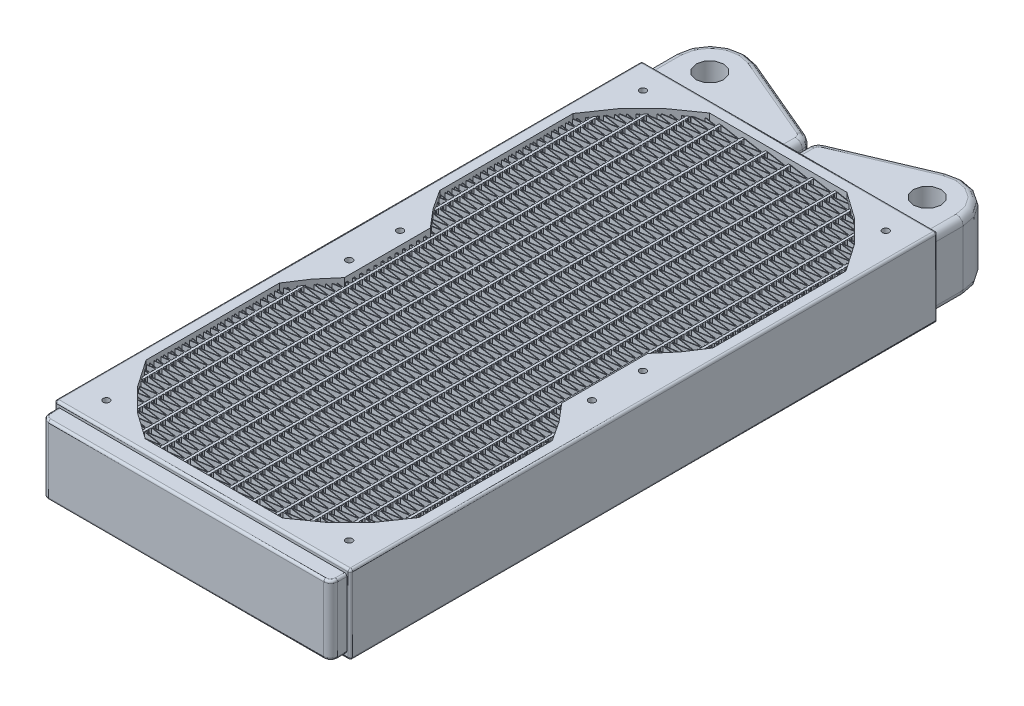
SolidWorks part; units mm, degrees
ref_plane "Front" through (0, 0, 0) normal (0, 0, 1) x (1, 0, 0)
ref_plane "Top" through (0, 0, 0) normal (0, 1, 0) x (1, 0, 0)
ref_plane "Right" through (0, 0, 0) normal (1, 0, 0) x (0, 0, -1)
sketch "Sketch1" plane through (0, 0, 0) normal (0, 1, 0) x (1, 0, 0)
  line L0 (-64, 7) -> (64, 7)
  line L1 (-64, 289) -> (64, 289) construction
  line L2 (-64, 289) -> (-64, 0) construction
  line L3 (-64, 0) -> (64, 0) construction
  line L4 (64, 289) -> (64, 0) construction
  line L5 (64, 7) -> (64, 261)
  line L6 (64, 261) -> (-64, 261)
  line L7 (-64, 261) -> (-64, 7)
  line L8 (0, -618) -> (0, 49382) construction
  line L9 (29.6957, 256) -> (-29.6957, 256)
  line L10 (-59, 226.3259) -> (-59, 168.6741)
  line L11 (-52.5, 145) -> (52.5, 250) construction
  line L12 (-52.5, 250) -> (52.5, 145) construction
  line L13 (-47, 152.5955) -> (-47, 115.4045)
  line L14 (59, 226.3259) -> (59, 168.6741)
  line L15 (47, 152.5955) -> (47, 115.4045)
  line L16 (-47, 134) -> (47, 134) construction
  line L17 (-52.5, 123) -> (52.5, 18) construction
  line L18 (-52.5, 18) -> (52.5, 123) construction
  line L20 (59, 99.3259) -> (59, 41.6741)
  line L21 (-59, 99.3259) -> (-59, 41.6741)
  line L27 (29.6957, 12) -> (-29.6957, 12)
  arc A0 (-29.6957, 256) -> (-59, 226.3259) centre (10.6066, 186.8934) ccw
  arc A1 (-59, 168.6741) -> (-47, 152.5955) centre (10.6066, 208.1066) ccw
  circle A2 centre (0, 197.5) radius 60 construction
  arc A3 (29.6957, 256) -> (59, 226.3259) centre (-10.6066, 186.8934) cw
  arc A4 (59, 168.6741) -> (47, 152.5955) centre (-10.6066, 208.1066) cw
  arc A5 (-59, 99.3259) -> (-47, 115.4045) centre (10.6066, 59.8934) cw
  arc A6 (59, 99.3259) -> (47, 115.4045) centre (-10.6066, 59.8934) ccw
  circle A7 centre (0, 70.5) radius 60 construction
  arc A14 (29.6957, 12) -> (59, 41.6741) centre (-10.6066, 81.1066) ccw
  arc A15 (-29.6957, 12) -> (-59, 41.6741) centre (10.6066, 81.1066) cw
  point P12 (0, 261)
  point P19 (-52.5, 250)
  point P20 (-52.5, 145)
  point P21 (52.5, 145)
  point P22 (52.5, 250)
  point P31 (0, 256)
  dimension "D10" = 120
  dimension "D11" = 80
  dimension "D14" = 80
  dimension "D2" = 128
  dimension "D3" = 7
  dimension "D4" = 28
  dimension "D5" = 5
  dimension "D6" = 5
  dimension "D7" = 105
  dimension "D8" = 39
  dimension "D9" = 105
  dimension "D12" = 15
  dimension "D13" = 15
  dimension "D15" = 17
  dimension "D16" = 22
  dimension "D17" = 5
extrude "Extrude1" add sketch "Sketch1" along normal mid plane 34
sketch "Sketch2" plane through (0, 0, 0) normal (0, 1, 0) x (1, 0, 0)
  line L0 (0, -997.0672) -> (0, 48929.5601) construction
  line L1 (29.6957, 12) -> (-29.6957, 12) construction
  line L2 (5, 256) -> (5, 12) construction
  line L3 (29.6957, 256) -> (-29.6957, 256) construction
  line L5 (-5, 12) -> (-5, 256) construction
  line L6 (-5, 256) -> (5, 254.4654)
  line L7 (5, 254.4654) -> (-5, 252.9308)
  line L8 (-5, 252.9308) -> (5, 251.3962)
  line L9 (5, 251.3962) -> (-5, 249.8616)
  line L10 (-5, 249.8616) -> (5, 248.327)
  line L11 (5, 248.327) -> (-5, 246.7925)
  line L12 (-5, 246.7925) -> (5, 245.2579)
  line L13 (5, 245.2579) -> (-5, 243.7233)
  line L14 (-5, 243.7233) -> (5, 242.1887)
  line L15 (5, 242.1887) -> (-5, 240.6541)
  line L16 (-5, 240.6541) -> (5, 239.1195)
  line L17 (5, 239.1195) -> (-5, 237.5849)
  line L18 (-5, 237.5849) -> (5, 236.0503)
  line L19 (5, 236.0503) -> (-5, 234.5157)
  line L20 (-5, 234.5157) -> (5, 232.9811)
  line L21 (5, 232.9811) -> (-5, 231.4465)
  line L22 (-5, 231.4465) -> (5, 229.9119)
  line L23 (5, 229.9119) -> (-5, 228.3774)
  line L24 (-5, 228.3774) -> (5, 226.8428)
  line L25 (5, 226.8428) -> (-5, 225.3082)
  line L26 (-5, 225.3082) -> (5, 223.7736)
  line L27 (5, 223.7736) -> (-5, 222.239)
  line L28 (-5, 222.239) -> (5, 220.7044)
  line L29 (5, 220.7044) -> (-5, 219.1698)
  line L30 (-5, 219.1698) -> (5, 217.6352)
  line L31 (5, 217.6352) -> (-5, 216.1006)
  line L32 (-5, 216.1006) -> (5, 214.566)
  line L33 (5, 214.566) -> (-5, 213.0314)
  line L34 (-5, 213.0314) -> (5, 211.4969)
  line L35 (5, 211.4969) -> (-5, 209.9623)
  line L36 (-5, 209.9623) -> (5, 208.4277)
  line L37 (5, 208.4277) -> (-5, 206.8931)
  line L38 (-5, 206.8931) -> (5, 205.3585)
  line L39 (5, 205.3585) -> (-5, 203.8239)
  line L40 (-5, 203.8239) -> (5, 202.2893)
  line L41 (5, 202.2893) -> (-5, 200.7547)
  line L42 (-5, 200.7547) -> (5, 199.2201)
  line L43 (5, 199.2201) -> (-5, 197.6855)
  line L44 (-5, 197.6855) -> (5, 196.1509)
  line L45 (5, 196.1509) -> (-5, 194.6164)
  line L46 (-5, 194.6164) -> (5, 193.0818)
  line L47 (5, 193.0818) -> (-5, 191.5472)
  line L48 (-5, 191.5472) -> (5, 190.0126)
  line L49 (5, 190.0126) -> (-5, 188.478)
  line L50 (-5, 188.478) -> (5, 186.9434)
  line L51 (5, 186.9434) -> (-5, 185.4088)
  line L52 (-5, 185.4088) -> (5, 183.8742)
  line L53 (5, 183.8742) -> (-5, 182.3396)
  line L54 (-5, 182.3396) -> (5, 180.805)
  line L55 (5, 180.805) -> (-5, 179.2704)
  line L56 (-5, 179.2704) -> (5, 177.7358)
  line L57 (5, 177.7358) -> (-5, 176.2013)
  line L58 (-5, 176.2013) -> (5, 174.6667)
  line L59 (5, 174.6667) -> (-5, 173.1321)
  line L60 (-5, 173.1321) -> (5, 171.5975)
  line L61 (5, 171.5975) -> (-5, 170.0629)
  line L62 (-5, 170.0629) -> (5, 168.5283)
  line L63 (5, 168.5283) -> (-5, 166.9937)
  line L64 (-5, 166.9937) -> (5, 165.4591)
  line L65 (5, 165.4591) -> (-5, 163.9245)
  line L66 (-5, 163.9245) -> (5, 162.3899)
  line L67 (5, 162.3899) -> (-5, 160.8553)
  line L68 (-5, 160.8553) -> (5, 159.3208)
  line L69 (5, 159.3208) -> (-5, 157.7862)
  line L70 (-5, 157.7862) -> (5, 156.2516)
  line L71 (5, 156.2516) -> (-5, 154.717)
  line L72 (-5, 154.717) -> (5, 153.1824)
  line L73 (5, 153.1824) -> (-5, 151.6478)
  line L74 (-5, 151.6478) -> (5, 150.1132)
  line L75 (5, 150.1132) -> (-5, 148.5786)
  line L76 (-5, 148.5786) -> (5, 147.044)
  line L77 (5, 147.044) -> (-5, 145.5094)
  line L78 (-5, 145.5094) -> (5, 143.9748)
  line L79 (5, 143.9748) -> (-5, 142.4403)
  line L80 (-5, 142.4403) -> (5, 140.9057)
  line L81 (5, 140.9057) -> (-5, 139.3711)
  line L82 (-5, 139.3711) -> (5, 137.8365)
  line L83 (5, 137.8365) -> (-5, 136.3019)
  line L84 (-5, 136.3019) -> (5, 134.7673)
  line L85 (5, 134.7673) -> (-5, 133.2327)
  line L86 (-5, 133.2327) -> (5, 131.6981)
  line L87 (5, 131.6981) -> (-5, 130.1635)
  line L88 (-5, 130.1635) -> (5, 128.6289)
  line L89 (5, 128.6289) -> (-5, 127.0943)
  line L90 (-5, 127.0943) -> (5, 125.5597)
  line L91 (5, 125.5597) -> (-5, 124.0252)
  line L92 (-5, 124.0252) -> (5, 122.4906)
  line L93 (5, 122.4906) -> (-5, 120.956)
  line L94 (-5, 120.956) -> (5, 119.4214)
  line L95 (5, 119.4214) -> (-5, 117.8868)
  line L96 (-5, 117.8868) -> (5, 116.3522)
  line L97 (5, 116.3522) -> (-5, 114.8176)
  line L98 (-5, 114.8176) -> (5, 113.283)
  line L99 (5, 113.283) -> (-5, 111.7484)
  line L100 (-5, 111.7484) -> (5, 110.2138)
  line L101 (5, 110.2138) -> (-5, 108.6792)
  line L102 (-5, 108.6792) -> (5, 107.1447)
  line L103 (5, 107.1447) -> (-5, 105.6101)
  line L104 (-5, 105.6101) -> (5, 104.0755)
  line L105 (5, 104.0755) -> (-5, 102.5409)
  line L106 (-5, 102.5409) -> (5, 101.0063)
  line L107 (5, 101.0063) -> (-5, 99.4717)
  line L108 (-5, 99.4717) -> (5, 97.9371)
  line L109 (5, 97.9371) -> (-5, 96.4025)
  line L110 (-5, 96.4025) -> (5, 94.8679)
  line L111 (5, 94.8679) -> (-5, 93.3333)
  line L112 (-5, 93.3333) -> (5, 91.7987)
  line L113 (5, 91.7987) -> (-5, 90.2642)
  line L114 (-5, 90.2642) -> (5, 88.7296)
  line L115 (5, 88.7296) -> (-5, 87.195)
  line L116 (-5, 87.195) -> (5, 85.6604)
  line L117 (5, 85.6604) -> (-5, 84.1258)
  line L118 (-5, 84.1258) -> (5, 82.5912)
  line L119 (5, 82.5912) -> (-5, 81.0566)
  line L120 (-5, 81.0566) -> (5, 79.522)
  line L121 (5, 79.522) -> (-5, 77.9874)
  line L122 (-5, 77.9874) -> (5, 76.4528)
  line L123 (5, 76.4528) -> (-5, 74.9182)
  line L124 (-5, 74.9182) -> (5, 73.3836)
  line L125 (5, 73.3836) -> (-5, 71.8491)
  line L126 (-5, 71.8491) -> (5, 70.3145)
  line L127 (5, 70.3145) -> (-5, 68.7799)
  line L128 (-5, 68.7799) -> (5, 67.2453)
  line L129 (5, 67.2453) -> (-5, 65.7107)
  line L130 (-5, 65.7107) -> (5, 64.1761)
  line L131 (5, 64.1761) -> (-5, 62.6415)
  line L132 (-5, 62.6415) -> (5, 61.1069)
  line L133 (5, 61.1069) -> (-5, 59.5723)
  line L134 (-5, 59.5723) -> (5, 58.0377)
  line L135 (5, 58.0377) -> (-5, 56.5031)
  line L136 (-5, 56.5031) -> (5, 54.9686)
  line L137 (5, 54.9686) -> (-5, 53.434)
  line L138 (-5, 53.434) -> (5, 51.8994)
  line L139 (5, 51.8994) -> (-5, 50.3648)
  line L140 (-5, 50.3648) -> (5, 48.8302)
  line L141 (5, 48.8302) -> (-5, 47.2956)
  line L142 (-5, 47.2956) -> (5, 45.761)
  line L143 (5, 45.761) -> (-5, 44.2264)
  line L144 (-5, 44.2264) -> (5, 42.6918)
  line L145 (5, 42.6918) -> (-5, 41.1572)
  line L146 (-5, 41.1572) -> (5, 39.6226)
  line L147 (5, 39.6226) -> (-5, 38.0881)
  line L148 (-5, 38.0881) -> (5, 36.5535)
  line L149 (5, 36.5535) -> (-5, 35.0189)
  line L150 (-5, 35.0189) -> (5, 33.4843)
  line L151 (5, 33.4843) -> (-5, 31.9497)
  line L152 (-5, 31.9497) -> (5, 30.4151)
  line L153 (5, 30.4151) -> (-5, 28.8805)
  line L154 (-5, 28.8805) -> (5, 27.3459)
  line L155 (5, 27.3459) -> (-5, 25.8113)
  line L156 (-5, 25.8113) -> (5, 24.2767)
  line L157 (5, 24.2767) -> (-5, 22.7421)
  line L158 (-5, 22.7421) -> (5, 21.2075)
  line L159 (5, 21.2075) -> (-5, 19.673)
  line L160 (-5, 19.673) -> (5, 18.1384)
  line L161 (5, 18.1384) -> (-5, 16.6038)
  line L162 (-5, 16.6038) -> (5, 15.0692)
  line L163 (5, 15.0692) -> (-5, 13.5346)
  line L164 (-5, 13.5346) -> (5, 12)
  line L166 (5, 12) -> (-5, 10.4654)
  dimension "D1" = 5
  dimension "D2" = 10
extrude "Extrude-Thin2" add sketch "Sketch2" along normal mid plane 30 separate body thin
sketch "Sketch3" plane through (0, 0, 0) normal (0, 1, 0) x (1, 0, 0)
  line L1 (5, 256) -> (5, 12) construction
  line L3 (5, 256) -> (5, 12)
extrude "Extrude-Thin3" add sketch "Sketch3" along normal mid plane 30 thin
sketch "Sketch5" plane through (0, 0, 0) normal (0, 1, 0) x (1, 0, 0)
  line L0 (-5, 12) -> (-5, 256) construction
  line L1 (-5, 12) -> (-5, 256)
extrude "Extrude-Thin4" add sketch "Sketch5" along normal mid plane 30 thin
pattern_linear "LPattern1" count 7 spacing 10 along (-1, 0, 0) count 7 spacing 10 along (1, 0, 0) of "Extrude-Thin4", "Extrude-Thin3", "Extrude-Thin2"
sketch "Sketch6" plane through (0, 0, 0) normal (0, 1, 0) x (1, 0, 0)
  line L8 (-29.6957, 12) -> (29.6957, 12)
  line L9 (-29.6957, 12) -> (29.6957, 12)
  line L21 (59, 41.6741) -> (59, 99.3259)
  line L22 (47, 115.4045) -> (47, 152.5955)
  line L23 (59, 168.6741) -> (59, 226.3259)
  line L24 (29.6957, 256) -> (-29.6957, 256)
  line L25 (-59, 226.3259) -> (-59, 168.6741)
  line L26 (-47, 152.5955) -> (-47, 115.4045)
  line L27 (-59, 99.3259) -> (-59, 41.6741)
  line L33 (59, 41.6741) -> (59, 99.3259)
  line L34 (47, 115.4045) -> (47, 152.5955)
  line L35 (59, 168.6741) -> (59, 226.3259)
  line L36 (29.6957, 256) -> (-29.6957, 256)
  line L37 (-59, 226.3259) -> (-59, 168.6741)
  line L38 (-47, 152.5955) -> (-47, 115.4045)
  line L39 (-59, 99.3259) -> (-59, 41.6741)
  arc A8 (29.6957, 12) -> (59, 41.6741) centre (-10.6066, 81.1066) ccw
  arc A9 (29.6957, 12) -> (59, 41.6741) centre (-10.6066, 81.1066) ccw
  arc A10 (-59, 41.6741) -> (-29.6957, 12) centre (10.6066, 81.1066) ccw
  arc A11 (-59, 41.6741) -> (-29.6957, 12) centre (10.6066, 81.1066) ccw
  arc A14 (59, 99.3259) -> (47, 115.4045) centre (-10.6066, 59.8934) ccw
  arc A15 (47, 152.5955) -> (59, 168.6741) centre (-10.6066, 208.1066) ccw
  arc A16 (59, 226.3259) -> (29.6957, 256) centre (-10.6066, 186.8934) ccw
  arc A17 (-29.6957, 256) -> (-59, 226.3259) centre (10.6066, 186.8934) ccw
  arc A18 (-59, 168.6741) -> (-47, 152.5955) centre (10.6066, 208.1066) ccw
  arc A19 (-47, 115.4045) -> (-59, 99.3259) centre (10.6066, 59.8934) ccw
  arc A26 (59, 99.3259) -> (47, 115.4045) centre (-10.6066, 59.8934) ccw
  arc A27 (47, 152.5955) -> (59, 168.6741) centre (-10.6066, 208.1066) ccw
  arc A28 (59, 226.3259) -> (29.6957, 256) centre (-10.6066, 186.8934) ccw
  arc A29 (-29.6957, 256) -> (-59, 226.3259) centre (10.6066, 186.8934) ccw
  arc A30 (-59, 168.6741) -> (-47, 152.5955) centre (10.6066, 208.1066) ccw
  arc A31 (-47, 115.4045) -> (-59, 99.3259) centre (10.6066, 59.8934) ccw
  dimension "D2" = 0
extrude "Extrude2" cut sketch "Sketch6" against normal through all and the other way through all flip side to cut
hole_wizard "M3.5x0.6 Tapped Hole1" positions "Sketch8" profile "Sketch7" tap size "M3.5x0.6" standard "Ansi Metric"
sketch "Sketch8" plane through (0, 17, 0) normal (0, 1, 0) x (-1, 0, 0)
  point P7 (-52.5, -250)
  point P10 (52.5, -250)
  point P13 (52.5, -145)
  point P16 (-52.5, -145)
  point P19 (-52.5, -123)
  point P22 (52.5, -123)
  point P25 (52.5, -18)
  point P28 (-52.5, -18)
sketch "Sketch7" plane through (52.5, 17, -250) normal (1, 0, 0) x (0, 0, 1)
  line L0 (0, 0) -> (0, 34)
  line L1 (0, 34) -> (1.45, 34)
  line L2 (1.45, 34) -> (1.45, 0)
  line L5 (1.45, 0) -> (0, 0)
  line L11 (0, -6.35) -> (0, 107.95) construction
  dimension "Thru Tap Drill Dia." = 2.9
  dimension "Thru Tap Drill Depth" = 34
sketch "Sketch9" plane through (0, 0, 0) normal (0, 1, 0) x (1, 0, 0)
  line L0 (0, -200618) -> (0, 249382) construction
  line L1 (0, -200618) -> (0, 249382) construction
  line L2 (-1, 261) -> (-1, 267.5033)
  line L3 (64, 261) -> (-64, 261) construction
  line L4 (-4.0463, 272.1058) -> (-40.9437, 287.7678)
  line L5 (-62.5, 273.5) -> (-62.5, 261)
  line L6 (-62.5, 261) -> (-1, 261)
  line L7 (62.5, 261) -> (1, 261)
  line L8 (62.5, 273.5) -> (62.5, 261)
  line L9 (4.0463, 272.1058) -> (40.9437, 287.7678)
  line L10 (1, 261) -> (1, 267.5033)
  line L11 (-64, 289) -> (64, 289) construction
  line L12 (-62.5, 7) -> (-62.5, 3)
  line L13 (-64, 7) -> (64, 7) construction
  line L14 (-64, 0) -> (64, 0) construction
  line L15 (-59.5, 0) -> (59.5, 0)
  line L16 (62.5, 3) -> (62.5, 7)
  line L17 (-62.5, 7) -> (62.5, 7)
  arc A0 (-1, 267.5033) -> (-4.0463, 272.1058) centre (-6, 267.5033) ccw
  arc A1 (-40.9437, 287.7678) -> (-62.5, 273.5) centre (-47, 273.5) ccw
  arc A2 (40.9437, 287.7678) -> (62.5, 273.5) centre (47, 273.5) cw
  arc A3 (1, 267.5033) -> (4.0463, 272.1058) centre (6, 267.5033) cw
  arc A4 (-62.5, 3) -> (-59.5, 0) centre (-59.5, 3) ccw
  arc A5 (59.5, 0) -> (62.5, 3) centre (59.5, 3) ccw
  dimension "D5" = 5
  dimension "D6" = 3
  dimension "D1" = 2
  dimension "D2" = 94
  dimension "D3" = 125
  dimension "D4" = 23
extrude "Extrude3" add sketch "Sketch9" along normal mid plane 30
fillet "Fillet1" radius 1 10 edges at (-62.5, -15, -5) (-61.6213, -15, -0.8787) (0, -15, 0) (61.6213, -15, -0.8787) (62.5, -15, -5) (-62.5, 15, -5) (-61.6213, 15, -0.8787) (0, 15, 0) (61.6213, 15, -0.8787) (62.5, 15, -5)
fillet "Fillet3" radius 3
hole_wizard "1/4-18 NPSM Tapped Hole1" positions "Sketch11" profile "Sketch10" tap size "1/4-18 NPSM" standard "Ansi Inch"
sketch "Sketch11" plane through (0, -15, 0) normal (0, -1, 0) x (1, 0, 0)
  arc A0 (40.9437, -287.7678) -> (62.5, -273.5) centre (47, -273.5) ccw construction
  point P0 (-47, -273.5)
  point P4 (47, -273.5)
sketch "Sketch10" plane through (-47, -15, -273.5) normal (1, 0, 0) x (0, 0, -1)
  line L0 (0, 0) -> (0, 32)
  line L1 (0, 32) -> (5.9436, 32)
  line L2 (5.9436, 32) -> (5.9436, 0)
  line L5 (5.9436, 0) -> (0, 0)
  line L11 (0, -6.35) -> (0, 107.95) construction
  dimension "Thru Tap Drill Dia." = 11.8872
  dimension "Thru Tap Drill Depth" = 32
ref_plane "Plane1" through (0, 0, -134) normal (0, 0, 1) x (1, 0, 0)
